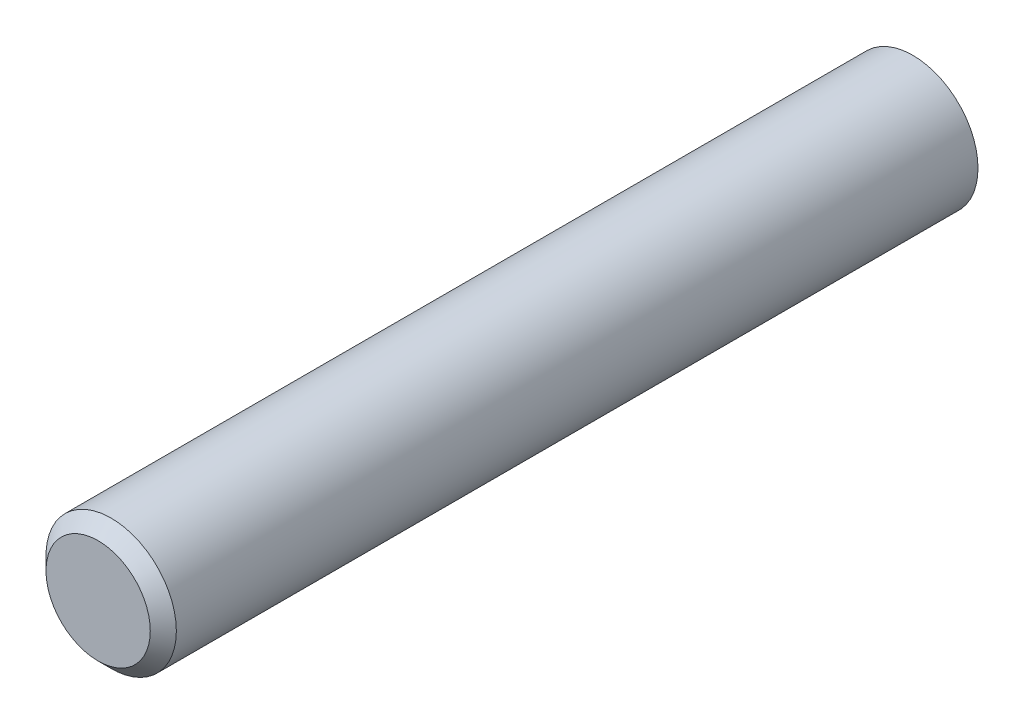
SolidWorks part; units mm, degrees
ref_plane "Front Plane" through (0, 0, 0) normal (0, 0, 1) x (1, 0, 0)
ref_plane "Top Plane" through (0, 0, 0) normal (0, 1, 0) x (1, 0, 0)
ref_plane "Right Plane" through (0, 0, 0) normal (1, 0, 0) x (0, 0, -1)
sketch "Sketch1" plane through (0, 0, 0) normal (0, 0, 1) x (1, 0, 0)
  circle A0 centre (0, 0) radius 4
  dimension "D1" = 8
extrude "Boss-Extrude1" add sketch "Sketch1" along normal mid plane 50
chamfer "Chamfer1" distance 0.8 angle 45 1 edges at (4, 0, 25)
